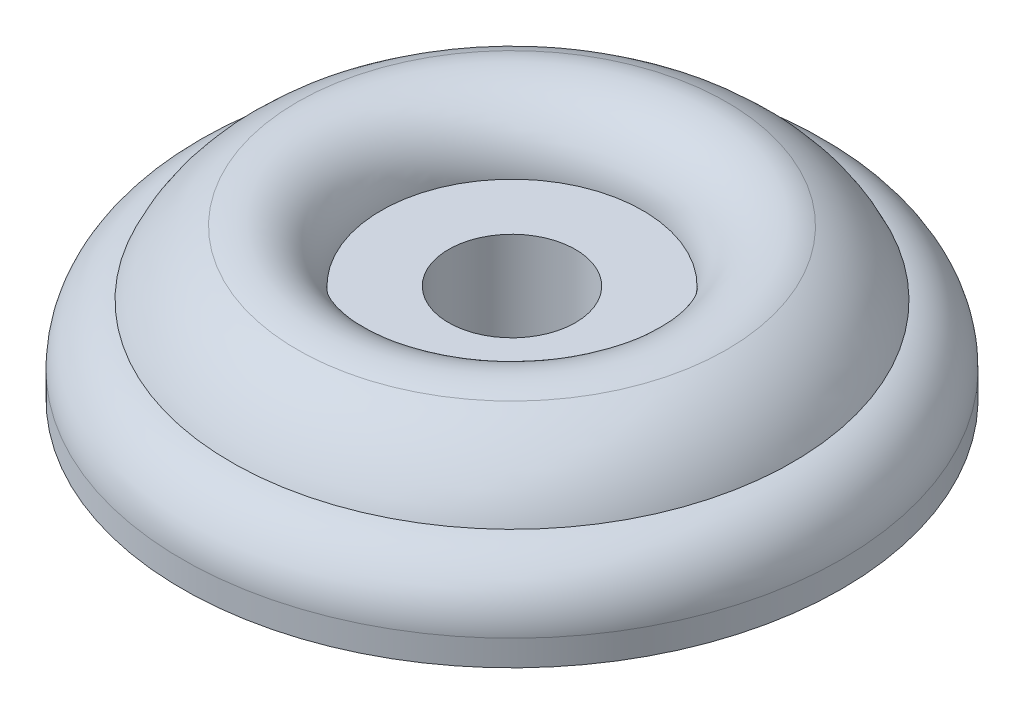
SolidWorks part; units mm, degrees
ref_plane "Спереди" through (0, 0, 0) normal (0, 0, 1) x (1, 0, 0)
ref_plane "Сверху" through (0, 0, 0) normal (0, 1, 0) x (1, 0, 0)
ref_plane "Справа" through (0, 0, 0) normal (1, 0, 0) x (0, 0, -1)
imported_body "Импортированный1"
sketch "Эскиз1" plane through (0, 29.1767, 0) normal (0, -1, 0) x (1, 0, 0)
  circle A0 centre (53.912, 0) radius 5.2
  dimension "D1" = 10.4
extrude "Вырез-Вытянуть1" cut sketch "Эскиз1" against normal through all
sketch "Эскиз2" plane through (0, 67.1767, 0) normal (0, 1, 0) x (1, 0, 0)
  line L1 (61.5658, -5.8223) -> (62.8069, 3.6726)
  line L2 (62.8069, 3.6726) -> (55.2047, 9.4948)
  line L3 (55.2047, 9.4948) -> (46.3614, 5.8223)
  line L4 (46.3614, 5.8223) -> (45.1203, -3.6726)
  line L5 (45.1203, -3.6726) -> (52.7225, -9.4948)
  line L6 (52.7225, -9.4948) -> (61.5658, -5.8223)
  circle A0 centre (53.9636, 0) radius 8.2927 construction
extrude "Вырез-Вытянуть2" cut sketch "Эскиз2" against normal up to surface (30 mm away)
